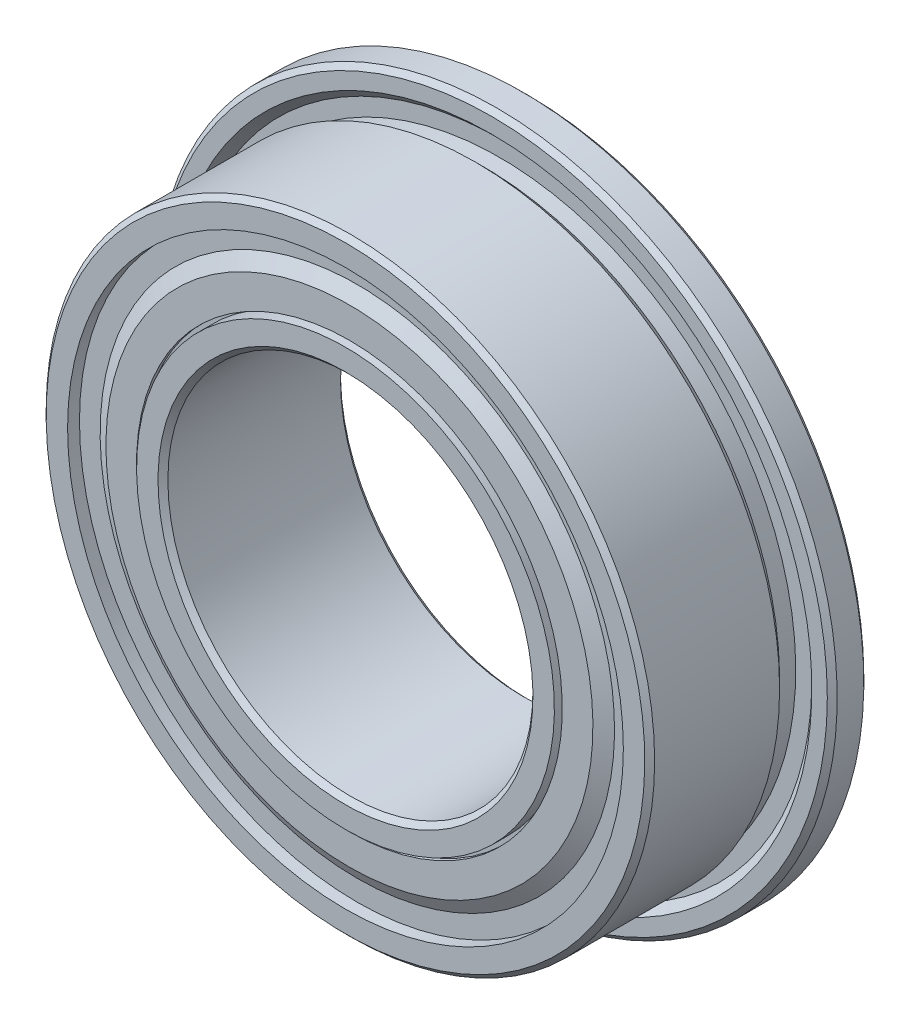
SolidWorks part; units mm, degrees
ref_plane "Front Plane" through (0, 0, 0) normal (0, 0, 1) x (1, 0, 0)
ref_plane "Top Plane" through (0, 0, 0) normal (0, 1, 0) x (1, 0, 0)
ref_plane "Right Plane" through (0, 0, 0) normal (1, 0, 0) x (0, 0, -1)
sketch "Sketch1" plane through (0, 0, 0) normal (1, 0, 0) x (0, 0, -1)
  line L0 (0, 5) -> (0, -5) construction
  line L1 (-1.5, 5) -> (1.5, 5) construction
  line L2 (0, 0) -> (1.5, 0) construction
  line L3 (1.5, 5.6) -> (1.5, -5.6) construction
  line L4 (1.5, -5.6) -> (0.9, -5.6) construction
  line L5 (1.5, 3) -> (0, 3) construction
  line L6 (1.5, 3) -> (1.5, -3) construction
sketch "Sketch2" plane through (0, 0, 0) normal (1, 0, 0) x (0, 0, -1)
  line L0 (1.5, 5.6) -> (0.9, 5.6)
  line L1 (0.9, 5.6) -> (0.9, 5.2652)
  line L2 (0.6348, 5) -> (-1.5, 5)
  line L3 (-1.5, 5) -> (-1.5, 4.35)
  line L4 (-1.5, 4.35) -> (-0.4873, 4.35)
  line L5 (1.5, 5.6) -> (1.5, -5.6) construction
  line L6 (1.5, 4.35) -> (1.5, 5.6)
  line L7 (1.5, 3) -> (-1.5, 3)
  line L8 (-1.5, 3) -> (-1.5, 3.65)
  line L9 (-1.5, 3.65) -> (-0.4873, 3.65)
  line L10 (1.5, 3.65) -> (1.5, 3)
  line L11 (0, 5) -> (0, 3) construction
  line L12 (-0.6, 4) -> (0.6, 4) construction
  line L13 (0.4873, 4.35) -> (1.5, 4.35)
  line L14 (0.4873, 3.65) -> (1.5, 3.65)
  line L15 (0.9, 5.2652) -> (1.0326, 5.1326)
  line L16 (1.0326, 5.1326) -> (1.0326, 4.8674)
  line L17 (1.0326, 4.8674) -> (0.7674, 4.8674)
  line L18 (0.7674, 4.8674) -> (0.6348, 5)
  line L19 (0.9, 5) -> (1.0326, 4.8674) construction
  line L20 (1.0326, 5.1326) -> (0.7674, 4.8674) construction
  line L21 (0.6348, 5) -> (0.9, 5) construction
  line L22 (0.9, 5) -> (0.9, 5.2652) construction
  line L23 (-1.5, 0) -> (1.5, 0) construction
  circle A0 centre (0, 4) radius 0.6 construction
  arc A1 (-0.4873, 4.35) -> (0.4873, 4.35) centre (0, 4) cw
  arc A2 (-0.4873, 3.65) -> (0.4873, 3.65) centre (0, 4) ccw
revolve "Revolve1" add sketch "Sketch2" angle 360 about L2
fillet "Fillet1" radius 0.0813 3 edges at (0, -5.6, -1.5) (0, -5.6, -0.9) (0, -5, 1.5)
sketch "Sketch3" plane through (0, 0, 0) normal (0, 0, 1) x (1, 0, 0)
  line L0 (-3, 0) -> (3, 0) construction
  line L1 (-5, 0) -> (5, 0) construction
  point P5 (0, 0)
fillet "Fillet2" radius 0.0813 2 edges at (0, -3, -1.5) (0, -3, 1.5)
sketch "Sketch7" plane through (0, 0, 0) normal (0, 0, 1) x (1, 0, 0)
  line L0 (0, 4.6) -> (0, 3.4)
  line L1 (0, 5.6) -> (0, -5.6) construction
  line L2 (-0.6979, 4.6) -> (0, 0) construction
  line L3 (0, 0) -> (0.6979, 4.6) construction
  line L4 (0.6979, 4.6) -> (-0.6979, 4.6) construction
  circle A0 centre (0, 4) radius 0.6 construction
  circle A1 centre (0, 0) radius 4.6 construction
  circle A2 centre (0, 0) radius 3.4 construction
  arc A4 (0, 4.6) -> (0, 3.4) centre (0, 4) ccw
revolve "Revolve3" add sketch "Sketch7" angle 360 about L0
pattern_circular "CirPattern3" count 17 over 360 about axis through (0, 0, 0) along (0, 0, 1)
sketch "Sketch8" plane through (0, 0, 0) normal (1, 0, 0) x (0, 0, -1)
  line L1 (-1.5, 4.35) -> (-1.24, 4.35)
  line L2 (-1.5, 4.35) -> (-1.5, 4.5667)
  line L3 (-1.5, 4.5667) -> (-1.24, 4.5667)
  line L4 (-1.24, 4.35) -> (-1.24, 4.5667)
  line L5 (1.5, 4.35) -> (1.24, 4.35)
  line L6 (1.5, 4.35) -> (1.5, 4.5667)
  line L7 (1.5, 4.5667) -> (1.24, 4.5667)
  line L8 (1.24, 4.35) -> (1.24, 4.5667)
  line L9 (1.5, 3.65) -> (1.24, 3.65)
  line L10 (1.5, 3.65) -> (1.5, 3.4333)
  line L11 (1.5, 3.4333) -> (1.24, 3.4333)
  line L12 (1.24, 3.65) -> (1.24, 3.4333)
  line L13 (-1.5, 3.65) -> (-1.24, 3.65)
  line L14 (-1.5, 3.65) -> (-1.5, 3.4333)
  line L15 (-1.5, 3.4333) -> (-1.24, 3.4333)
  line L16 (-1.24, 3.65) -> (-1.24, 3.4333)
revolve "Cut-Revolve1" cut sketch "Sketch8" angle 360 about L2
sketch "Sketch9" plane through (0, 0, 0) normal (1, 0, 0) x (0, 0, -1)
  line L0 (-1.24, 4.5667) -> (-1.24, 4.2095)
  line L1 (-1.24, 4.2095) -> (-1.37, 3.9844)
  line L2 (-1.37, 3.9844) -> (-1.37, 3.4983)
  line L3 (1.37, 3.4983) -> (1.37, 3.4333) construction
  line L4 (1.24, 4.5667) -> (1.24, 4.2095)
  line L5 (1.24, 4.2095) -> (1.37, 3.9844)
  line L6 (1.37, 3.9844) -> (1.37, 3.4983)
  line L7 (1.5, 3.4333) -> (1.24, 3.4333) construction
  line L8 (-1.305, 4.5667) -> (-1.305, 4.2269)
  line L9 (-1.305, 4.2269) -> (-1.435, 4.0018)
  line L10 (-1.435, 4.0018) -> (-1.435, 3.4983)
  line L11 (-1.24, 4.5667) -> (-1.305, 4.5667)
  line L12 (-1.37, 3.4983) -> (-1.435, 3.4983)
  line L13 (1.305, 4.5667) -> (1.305, 4.2269)
  line L14 (1.305, 4.2269) -> (1.435, 4.0018)
  line L15 (1.435, 4.0018) -> (1.435, 3.4983)
  line L16 (1.24, 4.5667) -> (1.305, 4.5667)
  line L17 (1.37, 3.4983) -> (1.435, 3.4983)
  line L18 (-1.24, 4.2095) -> (-1.24, 2.5308) construction
  line L19 (1.24, 4.2095) -> (1.24, 4.5667) construction
  line L20 (-1.24, 3.4333) -> (-1.5, 3.4333) construction
  line L22 (-1.37, 3.4983) -> (-1.37, 3.4333) construction
revolve "Revolve4" add sketch "Sketch9" angle 360 about L2
equation "\"D1@Fillet1\"=\"Race Thikness@Sketch2\"/8"
equation "\"ID2@Sketch3\" = \"ID@Sketch1\""
equation "\"OD2@Sketch3\" = \"OD@Sketch1\""
equation "\"D1@Fillet2\"=\"Race Thikness@Sketch2\"/8"
equation "\"D1@CirPattern3\"=360/\"D1@Sketch7\"-4"
equation "\"D1@Sketch8\"=\"Race Thikness@Sketch2\"/3"
equation "\"D2@Sketch8\"=\"Race Thikness@Sketch2\"/2.5"
equation "\"D3@Sketch9\"=\"D5@Sketch9\"/4"
equation "\"D4@Sketch9\"=\"D5@Sketch9\"/4"
equation "\"D1@Sketch9\"=\"D2@Sketch9\""
equation "\"Ball Dia.@Sketch2\" = \"D1@Sketch2\"*.5"
equation "\"D4@Sketch2\"=((\"OD@Sketch1\"-\"ID@Sketch1\")/2)*.35"
